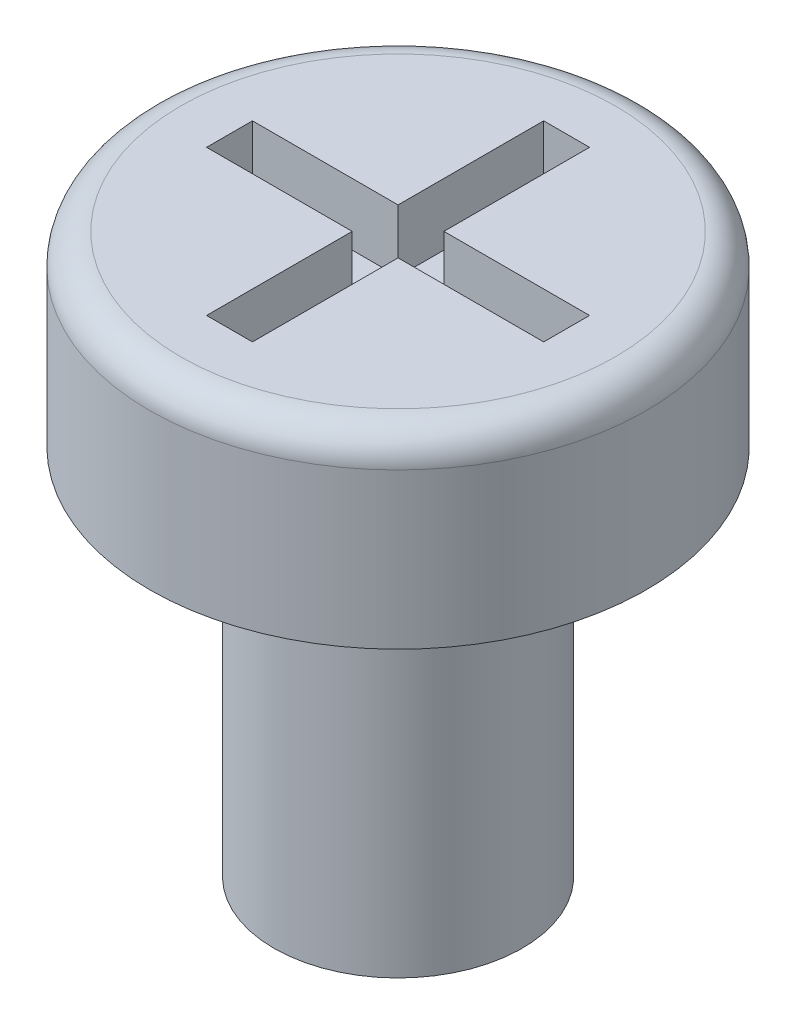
SolidWorks part; units mm, degrees
ref_plane "Front Plane" through (0, 0, 0) normal (0, 0, 1) x (1, 0, 0)
ref_plane "Top Plane" through (0, 0, 0) normal (0, 1, 0) x (1, 0, 0)
ref_plane "Right Plane" through (0, 0, 0) normal (1, 0, 0) x (0, 0, -1)
sketch "Sketch1" plane through (0, 0, 0) normal (0, 1, 0) x (1, 0, 0)
  circle A0 centre (0, 0) radius 1
extrude "Boss-Extrude1" add sketch "Sketch1" along normal blind 3
sketch "Sketch2" plane through (0, 3, 0) normal (0, 1, 0) x (1, 0, 0)
  circle A0 centre (0, 0) radius 2
extrude "Boss-Extrude2" add sketch "Sketch2" along normal blind 1.5
fillet "Fillet1" radius 0.25 1 edges at (0, 4.5, 2)
sketch "Sketch3" plane through (0, 4.5, 0) normal (0, 1, 0) x (1, 0, 0)
  line L0 (0.1846, 0.1846) -> (0.8733, 0.8733) construction
  line L1 (-0.1846, -1.3573) -> (0.1846, -1.3573)
  line L2 (-0.1846, -1.3573) -> (-0.1846, -0.1846)
  line L3 (-0.1846, 1.3573) -> (0.1846, 1.3573)
  line L4 (0.1846, -1.3573) -> (0.1846, -0.1846)
  line L7 (0.1846, 0.1846) -> (1.3573, 0.1846)
  line L8 (0.1846, -0.1846) -> (1.3573, -0.1846)
  line L9 (-1.3573, 0.1846) -> (-0.1846, 0.1846)
  line L10 (1.3573, -0.1846) -> (1.3573, 0.1846)
  line L11 (-1.3573, -0.1846) -> (-0.1846, -0.1846)
  line L12 (-1.3573, -0.1846) -> (-1.3573, 0.1846)
  line L13 (-0.1846, 0.1846) -> (-0.1846, 1.3573)
  line L16 (0.1846, 0.1846) -> (0.1846, 1.3573)
  point P0 (0, 0)
extrude "Cut-Extrude1" cut sketch "Sketch3" against normal blind 0.5
